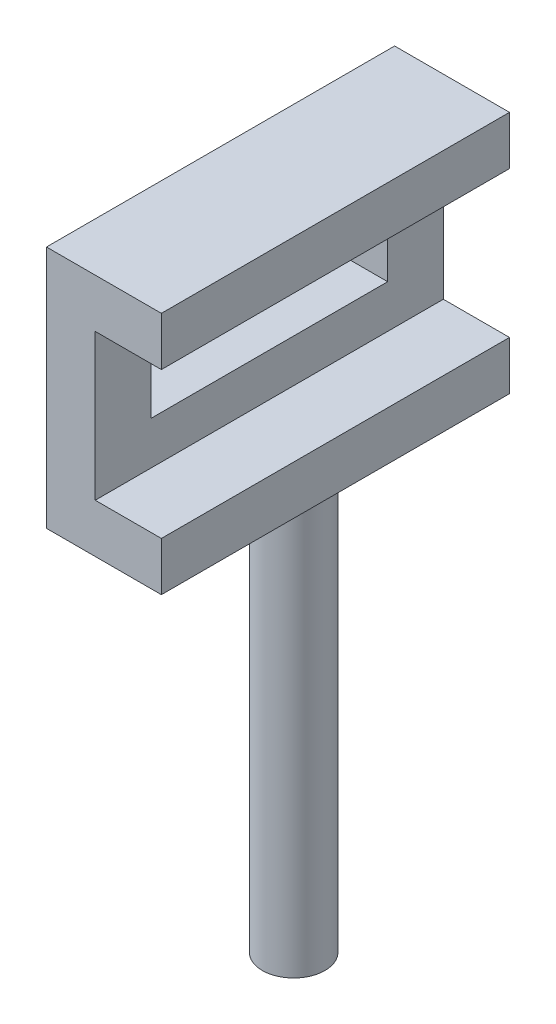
SolidWorks part; units mm, degrees
ref_plane "Plan de face" through (0, 0, 0) normal (0, 0, 1) x (1, 0, 0)
ref_plane "Plan de dessus" through (0, 0, 0) normal (0, 1, 0) x (1, 0, 0)
ref_plane "Plan de droite" through (0, 0, 0) normal (1, 0, 0) x (0, 0, -1)
sketch "Esquisse1" plane through (0, 0, 0) normal (0, 0, 1) x (1, 0, 0)
  line L0 (-31.3967, 15.7674) -> (-40.8967, 15.7674)
  line L1 (-40.8967, 15.7674) -> (-40.8967, -5.2326)
  line L2 (-40.8967, -5.2326) -> (-31.3967, -5.2326)
  line L3 (-31.3967, -5.2326) -> (-31.3967, -12.2326)
  line L4 (-31.3967, -12.2326) -> (-47.8967, -12.2326)
  line L5 (-47.8967, -12.2326) -> (-47.8967, 22.7674)
  line L6 (-47.8967, 22.7674) -> (-31.3967, 22.7674)
  line L7 (-31.3967, 22.7674) -> (-31.3967, 15.7674)
  dimension "D1" = 7
  dimension "D2" = 7
  dimension "D3" = 21
  dimension "D4" = 9.5
  dimension "D5" = 9.5
  dimension "D6" = 7
extrude "Boss.-Extru.1" add sketch "Esquisse1" along normal blind 50
sketch "Esquisse2" plane through (0, -12.2326, 0) normal (0, -1, 0) x (1, 0, 0)
  line L1 (-47.8967, 50) -> (-31.3967, 50) construction
  line L2 (-47.8967, 50) -> (-47.8967, 0) construction
  circle A0 centre (-37.3967, 25) radius 4.5
  dimension "D1" = 9
  dimension "D2" = 10.5
  dimension "D3" = 25
extrude "Boss.-Extru.2" add sketch "Esquisse2" along normal blind 60
sketch "Esquisse3" plane through (-47.8967, 0, 0) normal (-1, 0, 0) x (0, 0, 1)
  line L0 (50, 22.7674) -> (50, -12.2326) construction
  line L1 (8, 10.9487) -> (42, 10.9487)
  line L2 (8, 10.9487) -> (8, 0.9487)
  line L3 (8, 0.9487) -> (42, 0.9487)
  line L4 (42, 10.9487) -> (42, 0.9487)
  line L5 (0, 22.7674) -> (0, -12.2326) construction
  dimension "D1" = 8
  dimension "D2" = 8
  dimension "D3" = 10
extrude "Enlèv. mat.-Extru.1" cut sketch "Esquisse3" against normal blind 60
